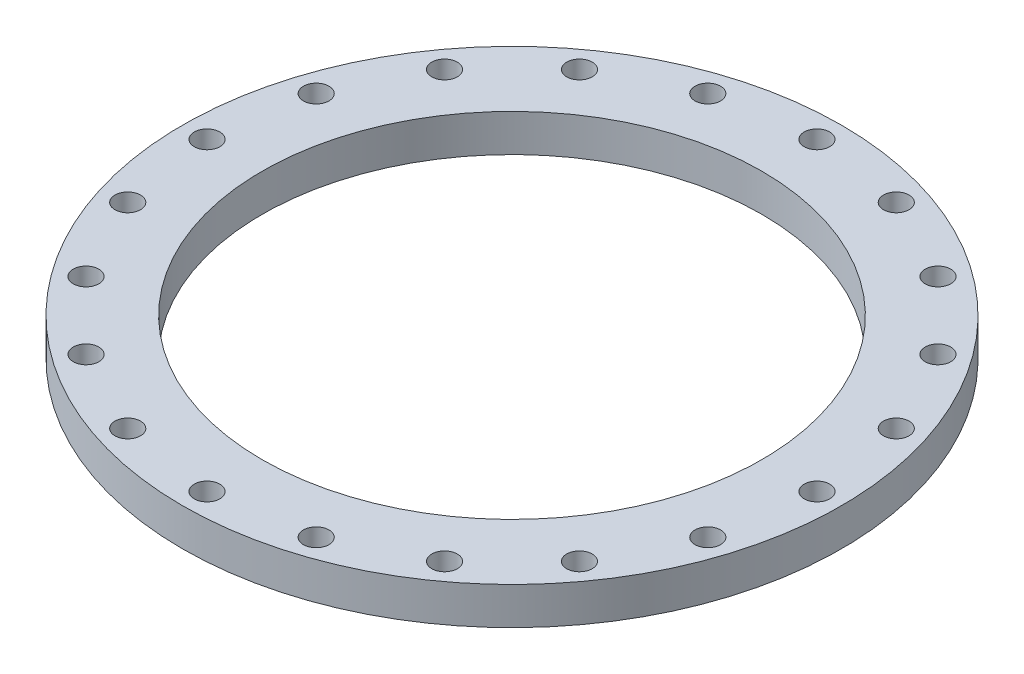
SolidWorks part; units mm, degrees
ref_plane "Plan de face" through (0, 0, 0) normal (0, 0, 1) x (1, 0, 0)
ref_plane "Plan de dessus" through (0, 0, 0) normal (0, 1, 0) x (1, 0, 0)
ref_plane "Plan de droite" through (0, 0, 0) normal (1, 0, 0) x (0, 0, -1)
ref_plane "Plan1" through (0, 38, 0) normal (0, 1, 0) x (1, 0, 0)
sketch "Esquisse1" plane through (0, 38, 0) normal (0, 1, 0) x (1, 0, 0)
  circle A0 centre (294.8275, -95.7953) radius 13
  circle A1 centre (250.7953, -182.2134) radius 13
  circle A2 centre (182.2134, -250.7953) radius 13
  circle A3 centre (95.7953, -294.8275) radius 13
  circle A4 centre (0, -310) radius 13
  circle A5 centre (-95.7953, -294.8275) radius 13
  circle A6 centre (-182.2134, -250.7953) radius 13
  circle A7 centre (-250.7953, -182.2134) radius 13
  circle A8 centre (-294.8275, -95.7953) radius 13
  circle A9 centre (-310, 0) radius 13
  circle A10 centre (-294.8275, 95.7953) radius 13
  circle A11 centre (-250.7953, 182.2134) radius 13
  circle A12 centre (-182.2134, 250.7953) radius 13
  circle A13 centre (-95.7953, 294.8275) radius 13
  circle A14 centre (0, 310) radius 13
  circle A15 centre (95.7953, 294.8275) radius 13
  circle A16 centre (182.2134, 250.7953) radius 13
  circle A17 centre (250.7953, 182.2134) radius 13
  circle A18 centre (294.8275, 95.7953) radius 13
  circle A19 centre (310, 0) radius 13
  circle A20 centre (0, 0) radius 254
  circle A21 centre (0, 0) radius 335
extrude "Boss.-Extru.1" add sketch "Esquisse1" against normal blind 38
